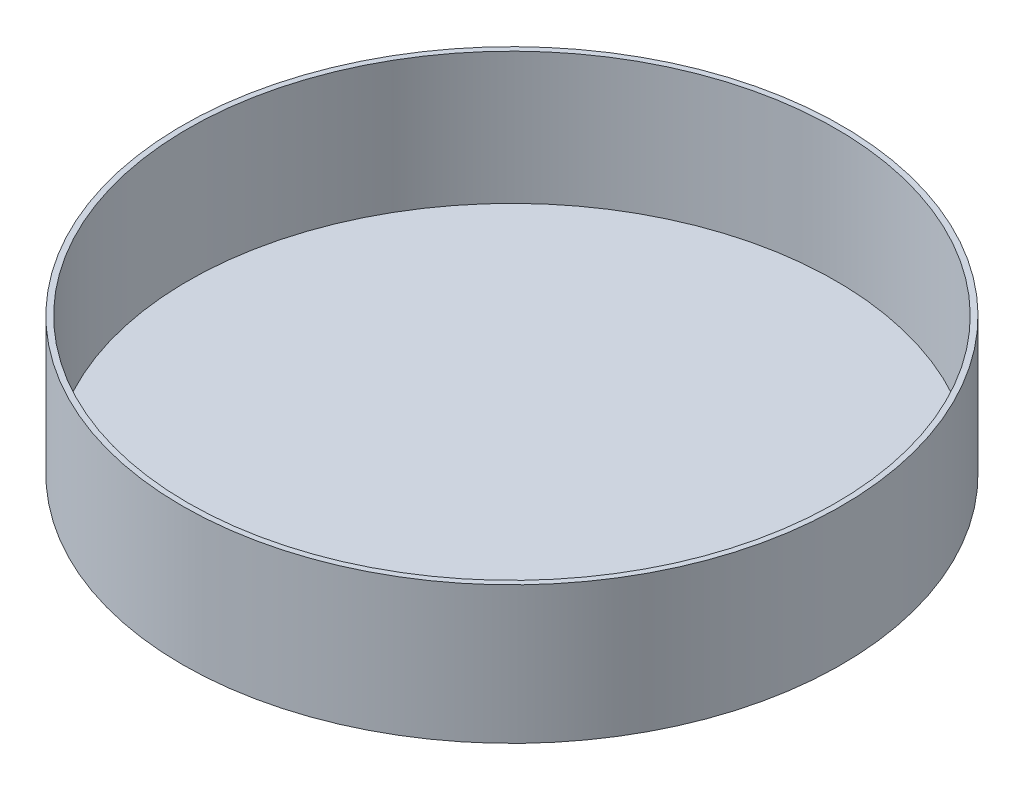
SolidWorks part; units mm, degrees
ref_plane "Alzado" through (0, 0, 0) normal (0, 0, 1) x (1, 0, 0)
ref_plane "Planta" through (0, 0, 0) normal (0, 1, 0) x (1, 0, 0)
ref_plane "Vista lateral" through (0, 0, 0) normal (1, 0, 0) x (0, 0, -1)
sketch "Croquis1" plane through (0, 0, 0) normal (0, 1, 0) x (1, 0, 0)
  circle A0 centre (0, 0) radius 60
  dimension "D1" = 120
extrude "Saliente-Extruir1" add sketch "Croquis1" along normal blind 25
sketch "Croquis2" plane through (0, 25, 0) normal (0, 1, 0) x (1, 0, 0)
  circle A0 centre (0, 0) radius 59
  dimension "D1" = 118
extrude "Cortar-Extruir1" cut sketch "Croquis2" against normal blind 24
